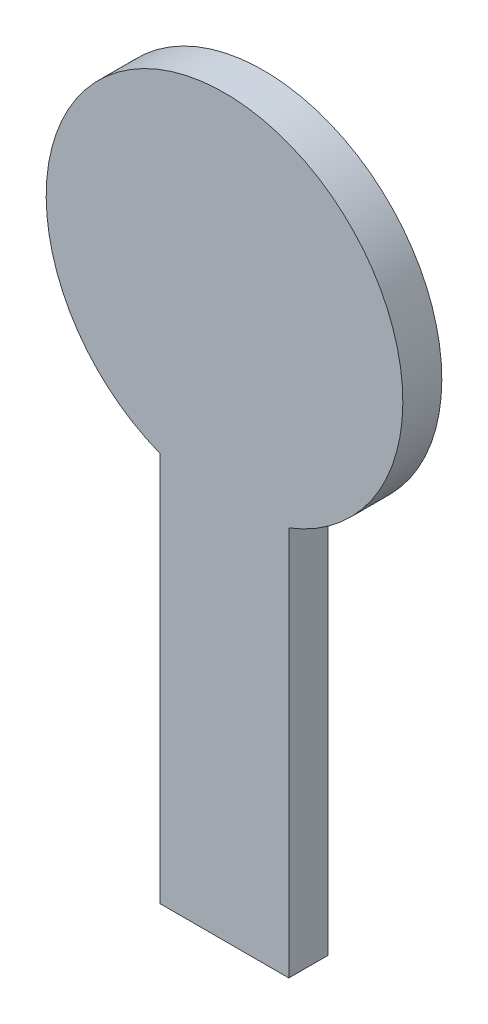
SolidWorks part; units mm, degrees
ref_plane "Front Plane" through (0, 0, 0) normal (0, 0, 1) x (1, 0, 0)
ref_plane "Top Plane" through (0, 0, 0) normal (0, 1, 0) x (1, 0, 0)
ref_plane "Right Plane" through (0, 0, 0) normal (1, 0, 0) x (0, 0, -1)
sketch "Sketch1" plane through (0, 0, 0) normal (0, 0, 1) x (1, 0, 0)
  line L0 (-3.3, -28.5342) -> (3.3, -28.5342)
  line L5 (-3.3, -28.5342) -> (-3.3, -8.5342)
  line L6 (3.3, -28.5342) -> (3.3, -8.5342)
  arc A0 (3.3, -8.5342) -> (-3.3, -8.5342) centre (0, 0) ccw
  point P3 (0, -28.5342)
  dimension "D1" = 18.3
  dimension "D2" = 6.6
  dimension "D3" = 20
extrude "Boss-Extrude1" add sketch "Sketch1" along normal blind 2
